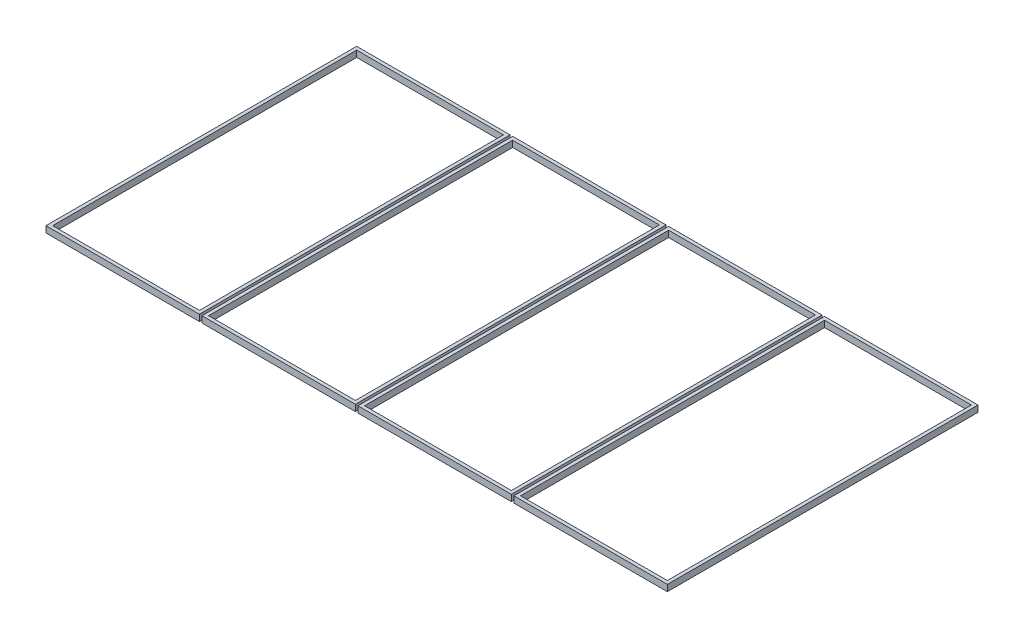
SolidWorks part; units mm, degrees
ref_plane "Front Plane" through (0, 0, 0) normal (0, 0, 1) x (1, 0, 0)
ref_plane "Top Plane" through (0, 0, 0) normal (0, 1, 0) x (1, 0, 0)
ref_plane "Right Plane" through (0, 0, 0) normal (1, 0, 0) x (0, 0, -1)
sketch "Sketch1" plane through (0, 0, 0) normal (0, 1, 0) x (1, 0, 0)
  line L0 (23, 1197) -> (579.5, 1197) construction
  line L2 (0, 0) -> (0, 1220)
  line L3 (0, 1220) -> (602.5, 1220)
  line L4 (2440, 0) -> (2440, 1220)
  line L5 (13, 1207) -> (589.5, 1207)
  line L9 (579.5, 1197) -> (579.5, 23) construction
  line L10 (13, 1207) -> (13, 13)
  line L11 (13, 13) -> (589.5, 13)
  line L12 (589.5, 1207) -> (589.5, 13)
  line L13 (625.5, 1207) -> (1202, 1207)
  line L14 (625.5, 1207) -> (625.5, 13)
  line L15 (625.5, 13) -> (1202, 13)
  line L16 (1202, 1207) -> (1202, 13)
  line L17 (0, 0) -> (13, 0)
  line L18 (13, 0) -> (589.5, 0)
  line L19 (589.5, 0) -> (602.5, 0)
  line L20 (625.5, 0) -> (1202, 0)
  line L21 (1238, 13) -> (1814.5, 13)
  line L22 (1238, 13) -> (1238, 1207)
  line L23 (1238, 1207) -> (1814.5, 1207)
  line L24 (1814.5, 13) -> (1814.5, 1207)
  line L25 (602.5, 0) -> (612.5, 0) construction
  line L26 (1238, 0) -> (1814.5, 0)
  line L27 (612.5, 0) -> (625.5, 0)
  line L28 (1850.5, 0) -> (2427, 0)
  line L29 (2427, 0) -> (2440, 0)
  line L30 (23, 23) -> (579.5, 23) construction
  line L31 (1850.5, 1207) -> (2427, 1207)
  line L32 (1850.5, 1207) -> (1850.5, 13)
  line L33 (1850.5, 13) -> (2427, 13)
  line L34 (2427, 1207) -> (2427, 13)
  line L35 (23, 1197) -> (23, 23) construction
  line L36 (635.5, 1197) -> (1192, 1197) construction
  line L37 (1192, 1197) -> (1192, 23) construction
  line L38 (635.5, 23) -> (1192, 23) construction
  line L39 (635.5, 1197) -> (635.5, 23) construction
  line L40 (1248, 1197) -> (1804.5, 1197) construction
  line L41 (1804.5, 23) -> (1804.5, 1197) construction
  line L42 (1248, 23) -> (1804.5, 23) construction
  line L43 (1248, 23) -> (1248, 1197) construction
  line L44 (1860.5, 1197) -> (1860.5, 23) construction
  line L45 (1860.5, 23) -> (2417, 23) construction
  line L46 (2417, 1197) -> (2417, 23) construction
  line L47 (1860.5, 1197) -> (2417, 1197) construction
  line L48 (1202, 0) -> (1215, 0)
  line L49 (1215, 0) -> (1225, 0) construction
  line L50 (1225, 0) -> (1238, 0)
  line L51 (1814.5, 0) -> (1827.5, 0)
  line L52 (1827.5, 0) -> (1837.5, 0) construction
  line L53 (1837.5, 0) -> (1850.5, 0)
  line L54 (602.5, 0) -> (602.5, 1220)
  line L55 (612.5, 0) -> (612.5, 1220)
  line L56 (1215, 0) -> (1215, 1220)
  line L57 (1225, 0) -> (1225, 1220)
  line L58 (1827.5, 0) -> (1827.5, 1220)
  line L59 (1837.5, 0) -> (1837.5, 1220)
  line L60 (612.5, 1220) -> (1215, 1220)
  line L61 (602.5, 1220) -> (612.5, 1220) construction
  line L62 (1225, 1220) -> (1827.5, 1220)
  line L63 (1215, 1220) -> (1225, 1220) construction
  line L64 (1837.5, 1220) -> (2440, 1220)
  line L65 (1827.5, 1220) -> (1837.5, 1220) construction
  line L66 (301.25, 1197) -> (301.25, 23) construction
extrude "Boss.-Extru.1" add sketch "Sketch1" along normal blind 25
equation "\"D12@Sketch1\"=\"tool_diameter\""
equation "\"tool_diameter\"=10"
equation "\"hole_clearance\"=0.1"
equation "\"material_thickness\"=25"
equation "\"clearance\"=0.1"
equation "\"outer_slot\"=0.5"
equation "\"fillet\"=7"
equation "\"D1@Boss.-Extru.1\"=\"material_thickness\""
equation "\"D5@Sketch1\"=\"tool_diameter\""
equation "\"D6@Sketch1\"=\"D5@Sketch1\""
